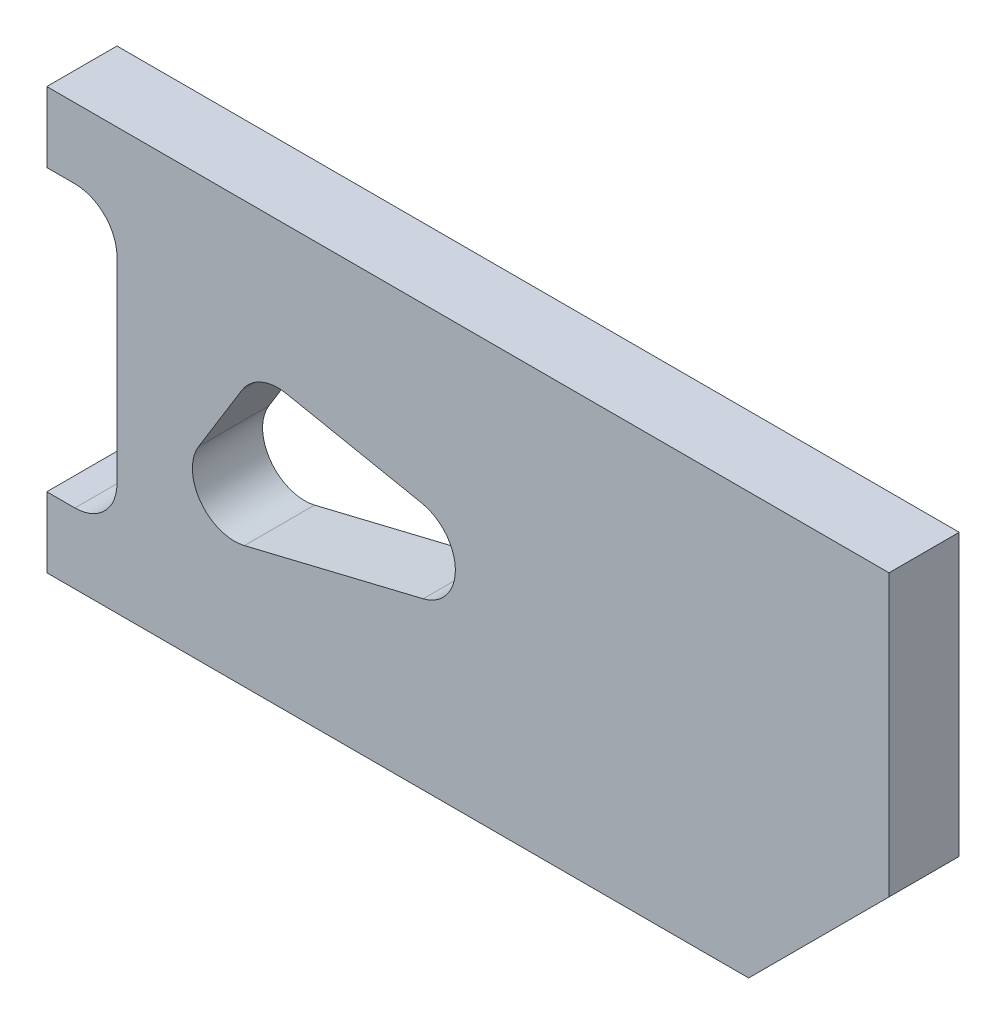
SolidWorks part; units mm, degrees
ref_plane "正面" through (0, 0, 0) normal (0, 0, 1) x (1, 0, 0)
ref_plane "平面" through (0, 0, 0) normal (0, 1, 0) x (1, 0, 0)
ref_plane "右側面" through (0, 0, 0) normal (1, 0, 0) x (0, 0, -1)
sketch "ｽｹｯﾁ1" plane through (0, 0, 0) normal (0, 0, 1) x (1, 0, 0)
  line L1 (0, 0) -> (50, 0)
  line L2 (0, 0) -> (0, 30)
  line L3 (0, 30) -> (60, 30)
  line L4 (60, 10) -> (60, 30)
  line L8 (50, 0) -> (60, 10)
  line L9 (10.8179, 13.2041) -> (13.9051, 18.2209)
  line L10 (17.0485, 19.5903) -> (26.696, 17.6608)
  line L11 (26.8145, 11.8035) -> (14.0797, 8.7163)
  line L13 (0, 25) -> (2, 25)
  line L14 (0, 25) -> (0, 5)
  line L15 (0, 5) -> (2, 5)
  line L16 (5, 22) -> (5, 8)
  arc A0 (14.0797, 8.7163) -> (10.8179, 13.2041) centre (13.3729, 11.6318) cw
  arc A1 (17.0485, 19.5903) -> (13.9051, 18.2209) centre (16.4601, 16.6486) ccw
  arc A2 (26.8145, 11.8035) -> (26.696, 17.6608) centre (26.1077, 14.7191) ccw
  arc A3 (5, 22) -> (2, 25) centre (2, 22) ccw
  arc A4 (2, 5) -> (5, 8) centre (2, 8) ccw
  point P3 (60, 0)
  point P14 (7, 7)
  point P17 (15, 20)
  point P20 (40, 15)
  point P25 (5, 25)
extrude "ﾎﾞｽ - 押し出し1" add sketch "ｽｹｯﾁ1" along normal blind 5 contours A4 L15 L2 L1 L8 L4 L3 L13 A3 L16 A2 L11 A0 L9 A1 L10
equation "\"A_x\"=7"
equation "\"A_y\"= 7"
equation "\"B_x\"=15"
equation "\"B_y\"=20"
equation "\"C_x\"= 40"
equation "\"C_y\"= 15"
equation "\"Cut_x\"= 10"
equation "\"Cut_y\"= 10"
equation "\"Dimension_y@ｽｹｯﾁ1\" = \"Cut_y\""
equation "\"D7@ｽｹｯﾁ1\"= \"Cut_x\""
equation "\"D2@ｽｹｯﾁ1\"= \"B_x\""
equation "\"D4@ｽｹｯﾁ1\"=\"C_x\""
equation "\"D5@ｽｹｯﾁ1\"=\"A_y\""
equation "\"D6@ｽｹｯﾁ1\"=\"B_y\""
equation "\"D8@ｽｹｯﾁ1\"=\"C_y\""
equation "\"D1@ｽｹｯﾁ1\"= \"A_x\""
